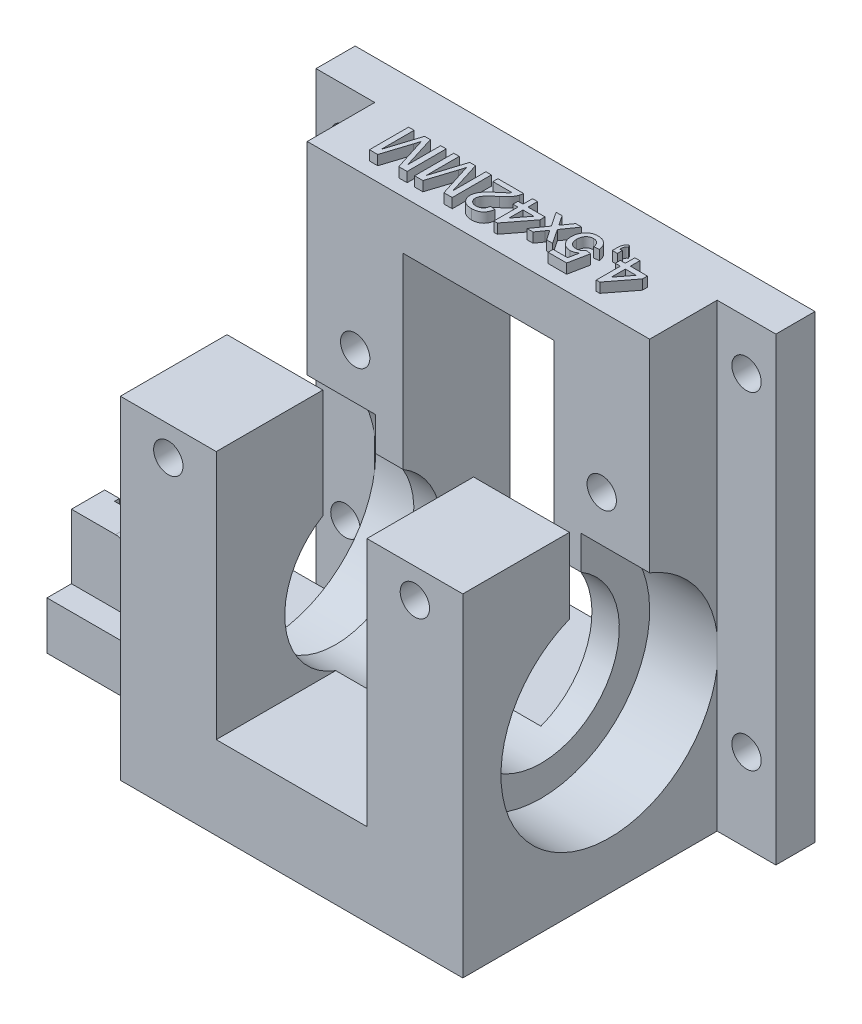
SolidWorks part; units mm, degrees
ref_plane "Спереди" through (0, 0, 0) normal (0, 0, 1) x (1, 0, 0)
ref_plane "Сверху" through (0, 0, 0) normal (0, 1, 0) x (1, 0, 0)
ref_plane "Справа" through (0, 0, 0) normal (1, 0, 0) x (0, 0, -1)
sketch "Эскиз1" plane through (0, 0, 0) normal (0, 1, 0) x (1, 0, 0)
  line L1 (17.5, -15) -> (-17.5, -15)
  line L2 (17.5, -15) -> (17.5, 15)
  line L3 (17.5, 15) -> (-17.5, 15)
  line L4 (-17.5, -15) -> (-17.5, 15)
  line L5 (17.5, -15) -> (-17.5, 15) construction
  line L6 (17.5, 15) -> (-17.5, -15) construction
  point P0 (0, 0)
  dimension "D1" = 35
  dimension "D2" = 30
extrude "Бобышка-Вытянуть1" add sketch "Эскиз1" along normal blind 42
sketch "Эскиз2" plane through (0, 42, 0) normal (0, 1, 0) x (1, 0, 0)
  line L0 (17.5, 15) -> (-17.5, 15) construction
  line L1 (7.7, -15) -> (-7.7, -15)
  line L2 (7.7, -15) -> (7.7, 15)
  line L3 (7.7, 15) -> (-7.7, 15)
  line L4 (-7.7, -15) -> (-7.7, 15)
  line L5 (7.7, -15) -> (-7.7, 15) construction
  line L6 (7.7, 15) -> (-7.7, -15) construction
  point P0 (0, 0)
  point P8 (0, 0)
  dimension "D1" = 9.8
  dimension "D2" = 15.4
extrude "Вырез-Вытянуть1" cut sketch "Эскиз2" against normal blind 33.5
sketch "Эскиз3" plane through (-17.5, 0, 0) normal (-1, 0, 0) x (0, 0, 1)
  line L0 (15, 16) -> (-15, 16) construction
  line L2 (15, 42) -> (15, 0) construction
  line L3 (-15, 42) -> (-15, 0) construction
  line L4 (-15, 0) -> (15, 0) construction
  circle A0 centre (0, 16) radius 11.1
  point P11 (0, 16)
  point P15 (0, 0)
  dimension "D1" = 22.2
  dimension "D2" = 16
extrude "Вырез-Вытянуть2" cut sketch "Эскиз3" against normal blind 7
sketch "Эскиз4" plane through (17.5, 0, 0) normal (1, 0, 0) x (0, 0, -1)
  line L0 (-15, 16) -> (15, 16) construction
  line L3 (-15, 42) -> (-15, 0) construction
  line L4 (15, 42) -> (15, 0) construction
  circle A0 centre (0, 16) radius 11.1
  dimension "D1" = 22.2
  dimension "D2" = 16
extrude "Вырез-Вытянуть3" cut sketch "Эскиз4" against normal blind 7
sketch "Эскиз5" plane through (-10.5, 0, 0) normal (-1, 0, 0) x (0, 0, 1)
  circle A0 centre (0, 16) radius 8
  dimension "D1" = 16
extrude "Вырез-Вытянуть4" cut sketch "Эскиз5" against normal through all
sketch "Эскиз6" plane through (0, 42, 0) normal (0, 1, 0) x (1, 0, 0)
  line L0 (17.5, -15) -> (17.5, 15) construction
  line L1 (-17.5, 4.1) -> (17.5, 4.1)
  line L2 (-17.5, 4.1) -> (-17.5, -4.1)
  line L3 (-17.5, -4.1) -> (17.5, -4.1)
  line L4 (17.5, 4.1) -> (17.5, -4.1)
  line L5 (-17.5, 4.1) -> (17.5, -4.1) construction
  line L6 (-17.5, -4.1) -> (17.5, 4.1) construction
  point P0 (0, 0)
  dimension "D1" = 8.2
extrude "Вырез-Вытянуть5" cut sketch "Эскиз6" against normal blind 20
sketch "Эскиз7" plane through (0, 0, -15) normal (0, 0, -1) x (-1, 0, 0)
  line L0 (-17.5, 31) -> (-7.7, 31) construction
  line L1 (-17.5, 42) -> (-17.5, 0) construction
  line L2 (-7.7, 8.5) -> (-7.7, 42) construction
  line L3 (7.7, 31) -> (17.5, 31) construction
  line L4 (7.7, 8.5) -> (7.7, 42) construction
  line L5 (17.5, 42) -> (17.5, 0) construction
  line L6 (-17.5, 42) -> (-7.7, 42) construction
  circle A0 centre (-12.6, 31) radius 1.5
  circle A1 centre (12.6, 31) radius 1.5
  point P12 (-12.6, 31)
  point P15 (-12.6, 42)
  dimension "D2" = 3
  dimension "D1" = 11
extrude "Вырез-Вытянуть6" cut sketch "Эскиз7" against normal through all
sketch "Эскиз9" plane through (-17.5, 0, 0) normal (1, 0, 0) x (0, 0, -1)
  line L0 (-15, 2.45) -> (15, 2.45) construction
  line L1 (-15, 42) -> (-15, 0) construction
  line L2 (15, 42) -> (15, 0) construction
  line L3 (0, 4.9) -> (0, 0) construction
  line L4 (-15, 0) -> (15, 0) construction
  line L6 (7.5, 0) -> (-7.5, 0)
  line L7 (7.5, 0) -> (7.5, 4.9)
  line L8 (7.5, 4.9) -> (-7.5, 4.9)
  line L9 (-7.5, 0) -> (-7.5, 4.9)
  line L10 (7.5, 0) -> (-7.5, 4.9) construction
  line L11 (7.5, 4.9) -> (-7.5, 0) construction
  circle A0 centre (0, 16) radius 11.1 construction
  point P13 (0, 2.45)
  point P14 (0, 2.45)
  point P15 (0, 2.45)
  dimension "D1" = 15
  dimension "D2" = 4.9
extrude "Бобышка-Вытянуть2" add sketch "Эскиз9" against normal blind 15
sketch "Эскиз10" plane through (0, 4.9, 0) normal (0, 1, 0) x (1, 0, 0)
  line L0 (-29.5, 7.5) -> (-29.5, -7.5) construction
  line L1 (-32.5, 7.5) -> (-17.5, 7.5) construction
  line L2 (-32.5, -7.5) -> (-17.5, -7.5) construction
  line L3 (-32.5, 7.5) -> (-32.5, -7.5) construction
  line L4 (-26.5, -5) -> (-32.5, -5)
  line L5 (-26.5, -5) -> (-26.5, 5)
  line L6 (-26.5, 5) -> (-32.5, 5)
  line L7 (-32.5, -5) -> (-32.5, 5)
  line L8 (-26.5, -5) -> (-32.5, 5) construction
  line L9 (-26.5, 5) -> (-32.5, -5) construction
  point P6 (-29.5, 0)
  point P13 (-32.5, 0)
  dimension "D1" = 10
  dimension "D2" = 3
extrude "Бобышка-Вытянуть3" add sketch "Эскиз10" along normal blind 6.6
sketch "Эскиз11" plane through (0, 11.5, 0) normal (0, 1, 0) x (1, 0, 0)
  line L0 (-26.5, 0) -> (-32.5, 0) construction
  line L1 (-26.5, -5) -> (-26.5, 5) construction
  line L2 (-32.5, 5) -> (-32.5, -5) construction
  line L3 (-31, 1.6) -> (-32.5, 1.6)
  line L4 (-31, -2.1) -> (-28, -2.1)
  line L5 (-31, 1.6) -> (-31, 2.1)
  line L6 (-31, 2.1) -> (-28, 2.1)
  line L7 (-28, -2.1) -> (-28, 2.1)
  line L8 (-31, -2.1) -> (-28, 2.1) construction
  line L9 (-31, 2.1) -> (-28, -2.1) construction
  line L10 (-32.5, 1.6) -> (-32.5, -1.6)
  line L11 (-32.5, -1.6) -> (-31, -1.6)
  line L12 (-31, -1.6) -> (-31, -2.1)
  point P6 (-29.5, 0)
  dimension "D1" = 4.2
  dimension "D2" = 3
  dimension "D3" = 3.2
extrude "Вырез-Вытянуть8" cut sketch "Эскиз11" against normal blind 1.3
sketch "Эскиз12" plane through (-32.5, 0, 0) normal (-1, 0, 0) x (0, 0, 1)
  line L0 (0, 10.2) -> (0, 0) construction
  line L1 (-1.6, 10.2) -> (1.6, 10.2) construction
  line L2 (7.5, 0) -> (-7.5, 0) construction
  line L4 (1.6, 0) -> (-1.6, 0)
  line L5 (1.6, 0) -> (1.6, 10.2)
  line L6 (1.6, 10.2) -> (-1.6, 10.2)
  line L7 (-1.6, 0) -> (-1.6, 10.2)
  line L8 (1.6, 0) -> (-1.6, 10.2) construction
  line L9 (1.6, 10.2) -> (-1.6, 0) construction
  point P6 (0, 5.1)
extrude "Вырез-Вытянуть9" cut sketch "Эскиз12" against normal blind 1
sketch "Эскиз13" plane through (-17.5, 0, 0) normal (-1, 0, 0) x (0, 0, 1)
  line L0 (-11.1, 16) -> (11.1, 16) construction
  line L1 (0, 16) -> (0, 0) construction
  circle A0 centre (0, 16) radius 11.1 construction
  circle A1 centre (0, 16) radius 11.1 construction
  dimension "D1" = 16
sketch "Эскиз14" plane through (0, 42, 0) normal (0, 1, 0) x (1, 0, 0)
  line L0 (17.5, 9.55) -> (-17.5, 9.55) construction
  line L1 (17.5, 4.1) -> (17.5, 15) construction
  line L2 (-17.5, 15) -> (-17.5, 4.1) construction
  line L4 (-17.5, 15) -> (17.5, 15)
  line L5 (-17.5, 15) -> (-17.5, 4.1)
  line L6 (-17.5, 4.1) -> (17.5, 4.1)
  line L7 (17.5, 15) -> (17.5, 4.1)
  line L8 (-17.5, 15) -> (17.5, 4.1) construction
  line L9 (-17.5, 4.1) -> (17.5, 15) construction
  point P6 (0, 9.55)
extrude "Бобышка-Вытянуть4" add sketch "Эскиз14" along normal blind 5
sketch "Эскиз15" plane through (0, 42, 0) normal (0, 1, 0) x (1, 0, 0)
  line L0 (-7.7, -4.1) -> (-17.5, -15) construction
  line L1 (17.5, -4.1) -> (7.7, -15) construction
  line L3 (-17.5, -15) -> (-7.7, -15)
  line L4 (-17.5, -15) -> (-17.5, -4.1)
  line L5 (-17.5, -4.1) -> (-7.7, -4.1)
  line L6 (-7.7, -15) -> (-7.7, -4.1)
  line L7 (-17.5, -15) -> (-7.7, -4.1) construction
  line L8 (-17.5, -4.1) -> (-7.7, -15) construction
  line L9 (7.7, -15) -> (17.5, -15)
  line L10 (7.7, -15) -> (7.7, -4.1)
  line L11 (7.7, -4.1) -> (17.5, -4.1)
  line L12 (17.5, -15) -> (17.5, -4.1)
  line L13 (7.7, -15) -> (17.5, -4.1) construction
  line L14 (7.7, -4.1) -> (17.5, -15) construction
  point P8 (-12.6, -9.55)
  point P9 (12.6, -9.55)
extrude "Вырез-Вытянуть10" cut sketch "Эскиз15" against normal blind 8
sketch "Эскиз17" plane through (0, 47, 0) normal (0, 1, 0) x (1, 0, 0)
  line L0 (17.5, 9.55) -> (-17.5, 9.55) construction
  line L1 (17.5, 4.1) -> (17.5, 15) construction
  line L2 (-17.5, 15) -> (-17.5, 4.1) construction
  text T0 "4,5x42MM"
extrude "Бобышка-Вытянуть5" add sketch "Эскиз17" along normal blind 1
sketch "Эскиз23" plane through (17.5, 0, 0) normal (1, 0, 0) x (0, 0, -1)
  line L0 (13, 47) -> (13, 0) construction
  line L1 (4.1, 47) -> (15, 47) construction
  line L2 (-15, 0) -> (15, 0) construction
  line L4 (11, 0) -> (15, 0)
  line L5 (11, 0) -> (11, 47)
  line L6 (11, 47) -> (15, 47)
  line L7 (15, 0) -> (15, 47)
  line L8 (11, 0) -> (15, 47) construction
  line L9 (11, 47) -> (15, 0) construction
  point P6 (13, 23.5)
  dimension "D1" = 2
extrude "Бобышка-Вытянуть7" add sketch "Эскиз23" along normal blind 6
sketch "Эскиз25" plane through (-17.5, 0, 0) normal (-1, 0, 0) x (0, 0, 1)
  line L0 (-13, 47) -> (-13, 0) construction
  line L1 (-15, 47) -> (-4.1, 47) construction
  line L2 (-15, 0) -> (-7.5, 0) construction
  line L4 (-11, 0) -> (-15, 0)
  line L5 (-11, 0) -> (-11, 47)
  line L6 (-11, 47) -> (-15, 47)
  line L7 (-15, 0) -> (-15, 47)
  line L8 (-11, 0) -> (-15, 47) construction
  line L9 (-11, 47) -> (-15, 0) construction
  point P6 (-13, 23.5)
  dimension "D1" = 2
extrude "Бобышка-Вытянуть8" add sketch "Эскиз25" along normal blind 6
sketch "Эскиз26" plane through (0, 0, -15) normal (0, 0, -1) x (-1, 0, 0)
  line L0 (-20.5, 42) -> (-20.5, 8.5) construction
  line L1 (-7.7, 42) -> (7.7, 42) construction
  line L2 (23.5, 47) -> (23.5, 0) construction
  line L5 (-20.5, 8.5) -> (20.5, 8.5) construction
  line L6 (20.5, 8.5) -> (20.5, 42) construction
  line L7 (20.5, 42) -> (-20.5, 42) construction
  circle A0 centre (-20.5, 42) radius 1.5
  circle A1 centre (-20.5, 8.5) radius 1.5
  circle A2 centre (20.5, 42) radius 1.5
  circle A3 centre (20.5, 8.5) radius 1.5
  point P4 (0, 42)
  point P7 (0, 42)
  dimension "D3" = 3
  dimension "D1" = 3
  dimension "D4" = 41
extrude "Вырез-Вытянуть12" cut sketch "Эскиз26" against normal through all
sketch "Эскиз27" plane through (0, 0, -15) normal (0, 0, -1) x (-1, 0, 0)
  circle A0 centre (12.6, 31) radius 3
  circle A1 centre (-12.6, 31) radius 3
  dimension "D1" = 6
extrude "Вырез-Вытянуть13" cut sketch "Эскиз27" against normal blind 3
fillet "Fillet1" radius 1.5 1 edges at (-26.5, 11.5, 0)
